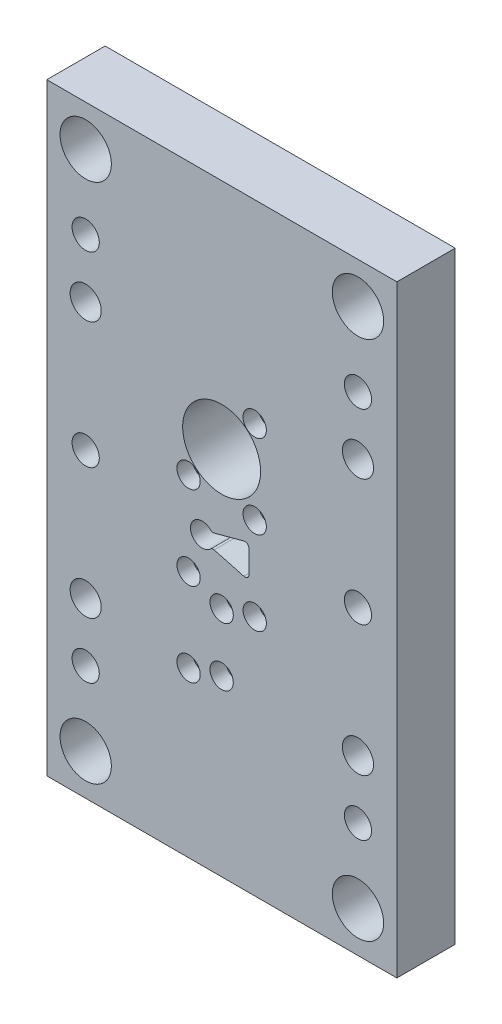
SolidWorks part; units mm, degrees
ref_plane "Plan de face" through (0, 0, 0) normal (0, 0, 1) x (1, 0, 0)
ref_plane "Plan de dessus" through (0, 0, 0) normal (0, 1, 0) x (1, 0, 0)
ref_plane "Plan de droite" through (0, 0, 0) normal (1, 0, 0) x (0, 0, -1)
sketch "Esquisse1" plane through (0, 0, 0) normal (0, 0, 1) x (1, 0, 0)
  line L0 (-45, -78) -> (45, -78)
  line L1 (45, -78) -> (45, 78)
  line L2 (45, 78) -> (-45, 78)
  line L3 (-45, 78) -> (-45, -78)
  line L4 (-35, -89.7182) -> (-35, 88.6791) construction
  line L5 (-57.3691, 0) -> (47.4228, 0) construction
  line L6 (-59.6476, -33) -> (62.5534, -33) construction
  line L7 (-59.6476, 33) -> (56.3599, 33) construction
  line L8 (-59.6476, 48) -> (56.3599, 48) construction
  line L9 (-59.6476, -48) -> (62.5534, -48) construction
  line L10 (35, -99.0045) -> (35, 88.6791) construction
  circle A0 centre (35, 33) radius 4.0038
  circle A1 centre (35, -33) radius 4.0038
  circle A5 centre (35, 67) radius 6.6
  circle A6 centre (35, -67) radius 6.6
  circle A7 centre (-35, -33) radius 4.0038
  circle A8 centre (-35, 33) radius 4.0038
  circle A12 centre (-35, -67) radius 6.6
  circle A13 centre (-35, 67) radius 6.6
  dimension "D1" = 8.0075
  dimension "D2" = 48
  dimension "D3" = 48
  dimension "D4" = 70
extrude "Extrusion1" add sketch "Esquisse1" along normal blind 15
ref_plane "Plan1" through (0, 0, -4) normal (0, 0, 1) x (1, 0, 0)
hole_wizard "Trou taraudé M8x1.01" positions "Esquisse3" profile "Esquisse2" tap size "M8x1.0" standard "Ansi Métrique"
sketch "Esquisse3" plane through (0, 0, 15) normal (0, 0, 1) x (1, 0, 0)
  line L0 (35, -99.0045) -> (35, 88.6791) construction
  line L1 (-35, -89.7182) -> (-35, 88.6791) construction
  line L2 (-59.6476, 48) -> (56.3599, 48) construction
  line L3 (-57.3691, 0) -> (47.4228, 0) construction
  line L4 (-59.6476, -48) -> (62.5534, -48) construction
  line L5 (35, -99.0045) -> (35, 88.6791) construction
  line L6 (-35, -89.7182) -> (-35, 88.6791) construction
  line L7 (-59.6476, 48) -> (56.3599, 48) construction
  line L8 (-57.3691, 0) -> (47.4228, 0) construction
  line L9 (-59.6476, -48) -> (62.5534, -48) construction
  point P0 (-35, 0)
  point P1 (-35, -48)
  point P3 (35, -48)
  point P7 (-35, 48)
  point P9 (35, 48)
  point P11 (35, 0)
sketch "Esquisse2" plane through (-35, 0, 15) normal (1, 0, 0) x (0, -1, 0)
  line L0 (0, 0) -> (0, 15)
  line L1 (0, 15) -> (3.5, 15)
  line L2 (3.5, 15) -> (3.5, 0)
  line L5 (3.5, 0) -> (0, 0)
  line L11 (0, -6.35) -> (0, 107.95) construction
  dimension "Diamètre du trou pour taraudage jusqu'au prochain" = 7
  dimension "Profondeur du trou pour taraudage jusqu'au prochain" = 15
sketch "Esquisse4" plane through (0, 0, 15) normal (0, 0, 1) x (1, 0, 0)
  line L0 (-93.5493, 0) -> (86.0824, 0) construction
  line L1 (-45, 77.5) -> (45, 77.5)
  line L2 (-45, -77.5) -> (45, -77.5)
  line L3 (-45, 78) -> (-45, -78) construction
  line L4 (-45, 77.5) -> (-45, -77.5)
  line L5 (45, -78) -> (45, 78) construction
  line L6 (45, -77.5) -> (45, 77.5)
  circle A0 centre (-35, 67) radius 6.6 construction
  circle A1 centre (-35, -67) radius 6.6 construction
  dimension "D1" = 155
extrude "Enlèv. mat.-Extru.2" cut sketch "Esquisse4" against normal through all flip side to cut
sketch "Esquisse5" plane through (0, 0, 15) normal (0, 0, 1) x (1, 0, 0)
  line L6 (-1.9666, -5.677) -> (5.6873, -7.7279)
  line L7 (6.965, -6.7474) -> (6.965, -0.8526)
  line L8 (5.6873, 0.1279) -> (-1.9666, -1.923)
  line L9 (-1.9666, -5.677) -> (5.6873, -7.7279)
  line L10 (6.965, -6.7474) -> (6.965, -0.8526)
  line L11 (5.6873, 0.1279) -> (-1.9666, -1.923)
  circle A2 centre (-0.05, 17.7) radius 10.015
  circle A3 centre (-0.05, 17.7) radius 10.015
  circle A8 centre (-8.55, -35.2679) radius 1.5025
  circle A9 centre (8.45, -15.3321) radius 1.5025
  circle A10 centre (-0.05, -32.8) radius 1.5025
  circle A11 centre (-0.05, -17.8) radius 1.5025
  circle A12 centre (-0.05, -17.8) radius 1.5 construction
  arc A13 (-2.9181, -1.6681) -> (-1.9666, -1.923) centre (-2.2216, -0.9716) ccw
  arc A14 (-2.9181, -1.6681) -> (-2.9181, -5.9319) centre (-5.05, -3.8) ccw
  arc A15 (-1.9666, -5.677) -> (-2.9181, -5.9319) centre (-2.2216, -6.6284) ccw
  arc A16 (5.6873, -7.7279) -> (6.965, -6.7474) centre (5.95, -6.7474) ccw
  arc A17 (6.965, -0.8526) -> (5.6873, 0.1279) centre (5.95, -0.8526) ccw
  arc A18 (-2.9181, -1.6681) -> (-1.9666, -1.923) centre (-2.2216, -0.9716) ccw
  arc A19 (-2.9181, -1.6681) -> (-2.9181, -5.9319) centre (-5.05, -3.8) ccw
  arc A20 (-1.9666, -5.677) -> (-2.9181, -5.9319) centre (-2.2216, -6.6284) ccw
  arc A21 (5.6873, -7.7279) -> (6.965, -6.7474) centre (5.95, -6.7474) ccw
  arc A22 (6.965, -0.8526) -> (5.6873, 0.1279) centre (5.95, -0.8526) ccw
  circle A23 centre (8.45, -15.3321) radius 1.5 construction
  circle A24 centre (-0.05, -32.8) radius 1.5 construction
  circle A25 centre (-8.55, -35.2679) radius 1.5 construction
  circle A26 centre (-8.55, -13.7679) radius 1.5025
  circle A27 centre (8.45, 6.1679) radius 1.5025
  circle A28 centre (-8.55, 7.7321) radius 1.5025
  circle A29 centre (8.45, 27.6679) radius 1.5025
  circle A30 centre (-8.55, -13.7679) radius 1.5 construction
  circle A31 centre (-8.55, 7.7321) radius 1.5 construction
  circle A32 centre (8.45, 6.1679) radius 1.5 construction
  circle A33 centre (8.45, 27.6679) radius 1.5 construction
  dimension "D3" = 3.005
  dimension "D1" = 0.015
  dimension "D2" = 0.015
extrude "Enlèv. mat.-Extru.3" cut sketch "Esquisse5" against normal through all
sketch "Esquisse6" plane through (0, 0, 15) normal (0, 0, 1) x (1, 0, 0)
  circle A0 centre (-8.55, -35.2679) radius 3
  circle A1 centre (-0.05, -32.8) radius 3
  circle A2 centre (-8.55, -13.7679) radius 3
  circle A3 centre (-0.05, -17.8) radius 3
  circle A4 centre (8.45, -15.3321) radius 3
  circle A5 centre (-8.55, 7.7321) radius 3
  circle A6 centre (8.45, 6.1679) radius 3
  circle A7 centre (8.45, 27.6679) radius 3
  dimension "D1" = 6
extrude "Enlèv. mat.-Extru.4" cut sketch "Esquisse6" against normal offset from surface (4.01 mm away) 0.01
